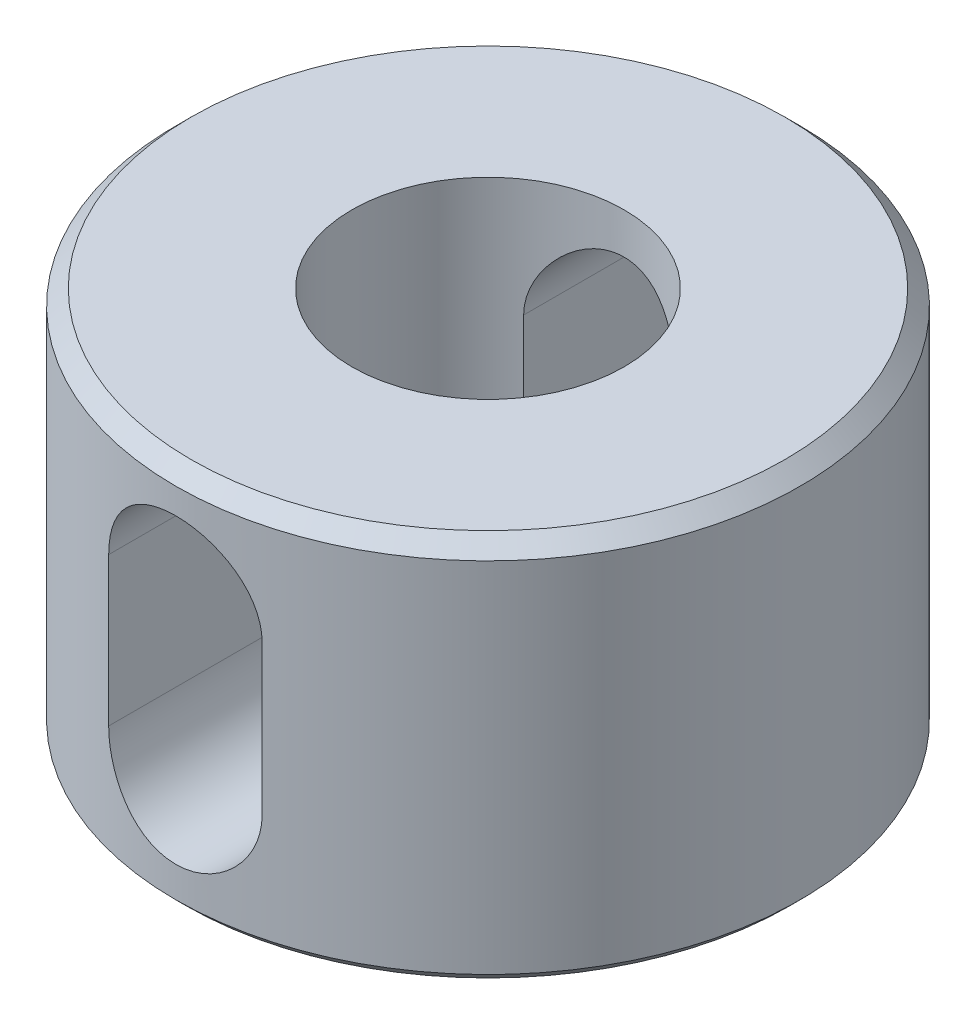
SolidWorks part; units mm, degrees
ref_plane "Front Plane" through (0, 0, 0) normal (0, 0, 1) x (1, 0, 0)
ref_plane "Top Plane" through (0, 0, 0) normal (0, 1, 0) x (1, 0, 0)
ref_plane "Right Plane" through (0, 0, 0) normal (1, 0, 0) x (0, 0, -1)
sketch "Sketch1" plane through (0, 0, 0) normal (0, 1, 0) x (1, 0, 0)
  circle A0 centre (0, 0) radius 7.747
  dimension "D1" = 15.494
extrude "rod" add sketch "Sketch1" along normal blind 9.525
sketch "Sketch5" plane through (0, 9.525, 0) normal (0, 1, 0) x (1, 0, 0)
  circle A0 centre (0, 0) radius 3.3782
  dimension "D1" = 6.7564
extrude "top cbore" cut sketch "Sketch5" against normal blind 8.89
chamfer "Chamfer1" distance 0.254 angle 45 1 edges at (0, 0, 7.747)
chamfer "Chamfer2" distance 0.381 angle 45 1 edges at (0, 9.525, 7.747)
sketch "Sketch10" plane through (0, 0, 0) normal (0, -1, 0) x (1, 0, 0)
  circle A0 centre (0, 0) radius 1.5875
  dimension "D1" = 3.175
extrude "bottom vent" cut sketch "Sketch10" against normal through all
sketch "Sketch11" plane through (0, 0, 0) normal (0, 0, 1) x (1, 0, 0)
  line L0 (0, 0) -> (0, 9.525) construction
  line L1 (3.3782, 9.525) -> (-3.3782, 9.525) construction
  line L2 (0, 2.921) -> (0, 6.604) construction
  line L3 (-1.905, 2.921) -> (-1.905, 6.604)
  line L4 (1.905, 2.921) -> (1.905, 6.604)
  line L5 (-7.493, 0) -> (7.493, 0) construction
  arc A1 (-1.905, 2.921) -> (1.905, 2.921) centre (0, 2.921) ccw
  arc A2 (1.905, 6.604) -> (-1.905, 6.604) centre (0, 6.604) ccw
  point P7 (0, 4.7625)
  dimension "D1" = 3.81
  dimension "D2" = 2.921
  dimension "D3" = 2.921
extrude "slot" cut sketch "Sketch11" against normal through all and the other way through all
